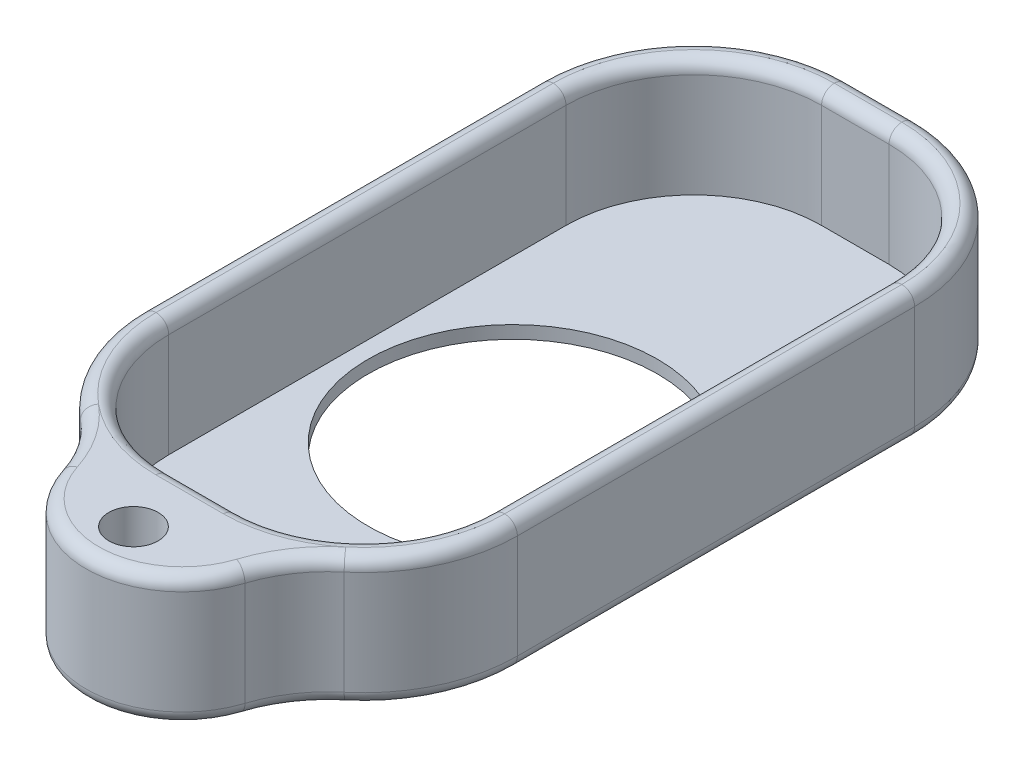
SolidWorks part; units mm, degrees
ref_plane "Front Plane" through (0, 0, 0) normal (0, 0, 1) x (1, 0, 0)
ref_plane "Top Plane" through (0, 0, 0) normal (0, 1, 0) x (1, 0, 0)
ref_plane "Right Plane" through (0, 0, 0) normal (1, 0, 0) x (0, 0, -1)
sketch "Sketch1" plane through (0, 0, 0) normal (0, 1, 0) x (1, 0, 0)
  line L1 (12.7, 0) -> (19.4056, 0)
  line L2 (0, 12.7) -> (0, 52.1716)
  line L3 (12.7, 64.8716) -> (19.4056, 64.8716)
  line L4 (32.1056, 12.7) -> (32.1056, 52.1716)
  line L5 (34.6456, 12.7) -> (34.6456, 52.1716)
  line L6 (12.7, 67.4116) -> (19.4056, 67.4116)
  line L7 (-2.54, 12.7) -> (-2.54, 52.1716)
  line L8 (12.7, -2.54) -> (19.4056, -2.54) construction
  arc A0 (12.7, 0) -> (0, 12.7) centre (12.7, 12.7) cw
  arc A1 (19.4056, 0) -> (32.1056, 12.7) centre (19.4056, 12.7) ccw
  arc A2 (19.4056, 64.8716) -> (32.1056, 52.1716) centre (19.4056, 52.1716) cw
  arc A3 (0, 52.1716) -> (12.7, 64.8716) centre (12.7, 52.1716) cw
  arc A4 (29.1521, 0.984) -> (34.6456, 12.7) centre (19.4056, 12.7) ccw
  arc A5 (19.4056, 67.4116) -> (34.6456, 52.1716) centre (19.4056, 52.1716) cw
  arc A6 (-2.54, 52.1716) -> (12.7, 67.4116) centre (12.7, 52.1716) cw
  arc A7 (2.9435, 0.9924) -> (-2.54, 12.7) centre (12.7, 12.7) cw
  arc A8 (6.9107, -4.8988) -> (25.1794, -4.9054) centre (16.0461, -1.9801) ccw
  arc A9 (12.7, -2.54) -> (-2.54, 12.7) centre (12.7, 12.7) cw construction
  arc A10 (19.4056, -2.54) -> (34.6456, 12.7) centre (19.4056, 12.7) ccw construction
  arc A11 (6.9107, -4.8988) -> (2.9435, 0.9924) centre (-5.1868, -8.764) ccw
  arc A12 (25.1794, -4.9054) -> (29.1521, 0.984) centre (37.2741, -8.7793) cw
  point P7 (0, 0)
  point P10 (32.1056, 0)
  point P13 (32.1056, 64.8716)
  point P16 (0, 64.8716)
  dimension "D3" = 12.7
  dimension "D5" = 12.7
  dimension "D6" = 12.7
  dimension "D1" = 64.8716
  dimension "D2" = 32.1056
  dimension "D4" = 2.54
extrude "Boss-Extrude1" add sketch "Sketch1" along normal blind 11.6078
sketch "Sketch2" plane through (0, 0, 0) normal (0, -1, 0) x (1, 0, 0)
  line L0 (34.6456, -12.7) -> (34.6456, -52.1716) construction
  line L1 (-2.54, -52.1716) -> (-2.54, -12.7) construction
  line L2 (19.4056, -67.4116) -> (12.7, -67.4116) construction
  line L3 (34.6456, -12.7) -> (34.6456, -52.1716)
  line L4 (-2.54, -52.1716) -> (-2.54, -12.7)
  line L5 (19.4056, -67.4116) -> (12.7, -67.4116)
  arc A0 (19.4056, -67.4116) -> (34.6456, -52.1716) centre (19.4056, -52.1716) ccw construction
  arc A1 (34.6456, -12.7) -> (29.1521, -0.984) centre (19.4056, -12.7) ccw construction
  arc A2 (25.1794, 4.9054) -> (29.1521, -0.984) centre (37.2741, 8.7793) ccw construction
  arc A3 (25.1794, 4.9054) -> (6.9107, 4.8988) centre (16.0461, 1.9801) ccw construction
  arc A4 (2.9435, -0.9924) -> (6.9107, 4.8988) centre (-5.1868, 8.764) ccw construction
  arc A5 (2.9435, -0.9924) -> (-2.54, -12.7) centre (12.7, -12.7) ccw construction
  arc A6 (-2.54, -52.1716) -> (12.7, -67.4116) centre (12.7, -52.1716) ccw construction
  arc A7 (19.4056, -67.4116) -> (34.6456, -52.1716) centre (19.4056, -52.1716) ccw
  arc A8 (34.6456, -12.7) -> (29.1521, -0.984) centre (19.4056, -12.7) ccw
  arc A9 (25.1794, 4.9054) -> (29.1521, -0.984) centre (37.2741, 8.7793) ccw
  arc A10 (25.1794, 4.9054) -> (6.9107, 4.8988) centre (16.0461, 1.9801) ccw
  arc A11 (2.9435, -0.9924) -> (6.9107, 4.8988) centre (-5.1868, 8.764) ccw
  arc A12 (2.9435, -0.9924) -> (-2.54, -12.7) centre (12.7, -12.7) ccw
  arc A13 (-2.54, -52.1716) -> (12.7, -67.4116) centre (12.7, -52.1716) ccw
extrude "Boss-Extrude2" add sketch "Sketch2" along normal blind 1.27
sketch "Sketch3" plane through (0, -1.27, 0) normal (0, -1, 0) x (1, 0, 0)
  line L0 (12.7, -67.4116) -> (19.4056, -67.4116) construction
  circle A0 centre (16.0528, -30.8356) radius 14.3777
  dimension "D1" = 36.576
extrude "Cut-Extrude1" cut sketch "Sketch3" against normal up to next
sketch "Sketch4" plane through (0, 11.6078, 0) normal (0, 1, 0) x (1, 0, 0)
  circle A0 centre (16.0426, -6.8456) radius 2.4522
extrude "Cut-Extrude2" cut sketch "Sketch4" against normal through all
fillet "Fillet1" radius 1.27 28 edges at (5.3473, -1.27, 1.6703) (16.0426, -1.27, 11.5704) (26.7455, -1.27, 1.6773) (33.204, -1.27, -6.23) (34.6456, -1.27, -32.4358) (30.1819, -1.27, -62.9479) (16.0528, -1.27, -67.4116) (1.9237, -1.27, -62.9479) (-2.54, -1.27, -32.4358) (28.3859, 11.6078, -3.7197) (16.0528, 11.6078, 0) (3.7197, 11.6078, -3.7197) (0, 11.6078, -32.4358) (3.7197, 11.6078, -61.1519) (16.0528, 11.6078, -64.8716) (28.3859, 11.6078, -61.1519) (33.204, 11.6078, -6.23) (26.7455, 11.6078, 1.6773) (16.0426, 11.6078, 11.5704) (5.3473, 11.6078, 1.6703) (-1.1012, 11.6078, -6.2359) (-2.54, 11.6078, -32.4358) (1.9237, 11.6078, -62.9479) (16.0528, 11.6078, -67.4116) (30.1819, 11.6078, -62.9479) (-1.1012, -1.27, -6.2359) (32.1056, 11.6078, -32.4358) (34.6456, 11.6078, -32.4358)
